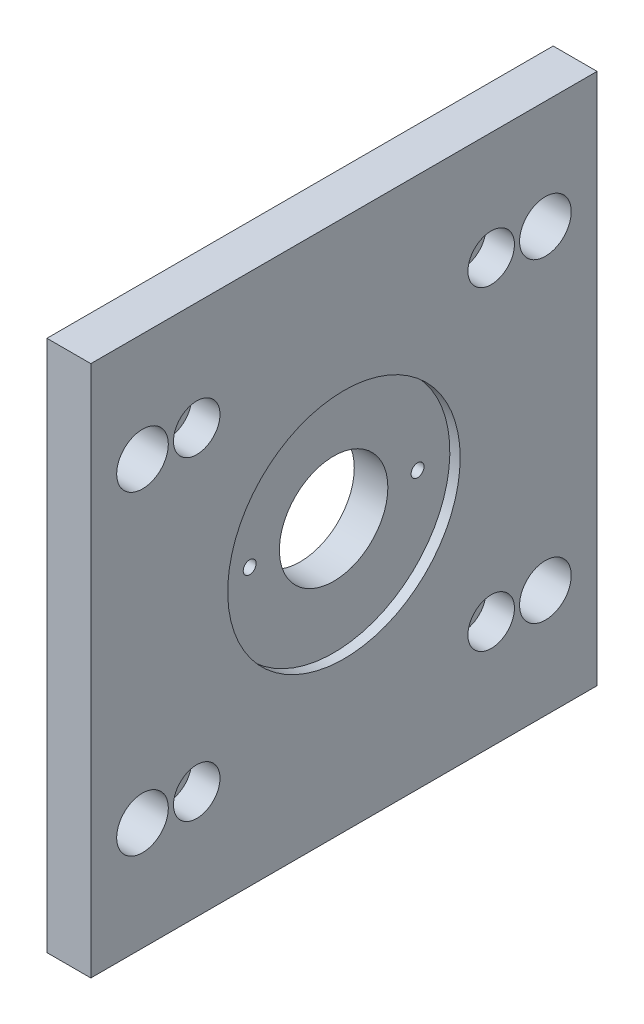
SolidWorks part; units mm, degrees
ref_plane "Face" through (0, 0, 0) normal (0, 0, 1) x (1, 0, 0)
ref_plane "Dessus" through (0, 0, 0) normal (0, 1, 0) x (1, 0, 0)
ref_plane "Droite" through (0, 0, 0) normal (1, 0, 0) x (0, 0, -1)
imported_body "Importée1"
sketch "Esquisse1" plane through (-4, 0, 0) normal (1, 0, 0) x (0, 0, -1)
  circle A0 centre (-98, 78) radius 10
  dimension "D1" = 20
extrude "Enlèv. mat.-Extru.1" cut sketch "Esquisse1" against normal through all
sketch "Esquisse2" plane through (-4, 0, 0) normal (1, 0, 0) x (0, 0, -1)
  circle A0 centre (-98, 78) radius 21
  dimension "D1" = 42
extrude "Enlèv. mat.-Extru.2" cut sketch "Esquisse2" against normal blind 15
hole_wizard "Trou taraudé M6x1.01" positions "Esquisse4" profile "Esquisse3" tap size "M6x1.0" standard "Ansi Métrique"
sketch "Esquisse4" plane through (-4, 0, 0) normal (1, 0, 0) x (0, 0, -1)
  point P0 (-130.5, 78)
  point P1 (-65.5, 78)
  dimension "D1" = 32.5
  dimension "D2" = 32.5
sketch "Esquisse3" plane through (-4, 78, 130.5) normal (0, 1, 0) x (0, 0, -1)
  line L0 (0, 0) -> (0, 13)
  line L1 (0, 13) -> (2.5, 13)
  line L2 (2.5, 13) -> (2.5, 0)
  line L5 (2.5, 0) -> (0, 0)
  line L11 (0, -6.35) -> (0, 107.95) construction
  dimension "Diamètre du trou pour taraudage jusqu'au prochain" = 5
  dimension "Profondeur du trou pour taraudage jusqu'au prochain" = 13
sketch "Esquisse7" plane through (0, 0, 0) normal (1, 0, 0) x (0, 0, -1)
  line L0 (-203.8736, 78) -> (9.7586, 78) construction
  line L1 (-98, 138.3197) -> (-98, 23.6495) construction
sketch "Esquisse8" plane through (0, 0, 0) normal (0, -1, 0) x (1, 0, 0)
  line L4 (0, 196) -> (-17, 196)
  line L5 (-17, 196) -> (-17, 0)
  line L6 (-17, 0) -> (0, 0)
  line L7 (0, 0) -> (0, 196)
  line L8 (0, 196) -> (-17, 196)
  line L9 (-17, 196) -> (-17, 0)
  line L10 (-17, 0) -> (0, 0)
  line L11 (0, 0) -> (0, 196)
  dimension "D1" = 0
extrude "Extrusion1" add sketch "Esquisse8" along normal blind 25
sketch "Esquisse9" plane through (0, 156, 0) normal (0, 1, 0) x (-1, 0, 0)
  line L4 (0, 0) -> (17, 0)
  line L5 (17, 0) -> (17, 196)
  line L6 (17, 196) -> (0, 196)
  line L7 (0, 196) -> (0, 0)
  line L8 (0, 0) -> (17, 0)
  line L9 (17, 0) -> (17, 196)
  line L10 (17, 196) -> (0, 196)
  line L11 (0, 196) -> (0, 0)
  dimension "D1" = 0
extrude "Extrusion2" add sketch "Esquisse9" along normal blind 25
